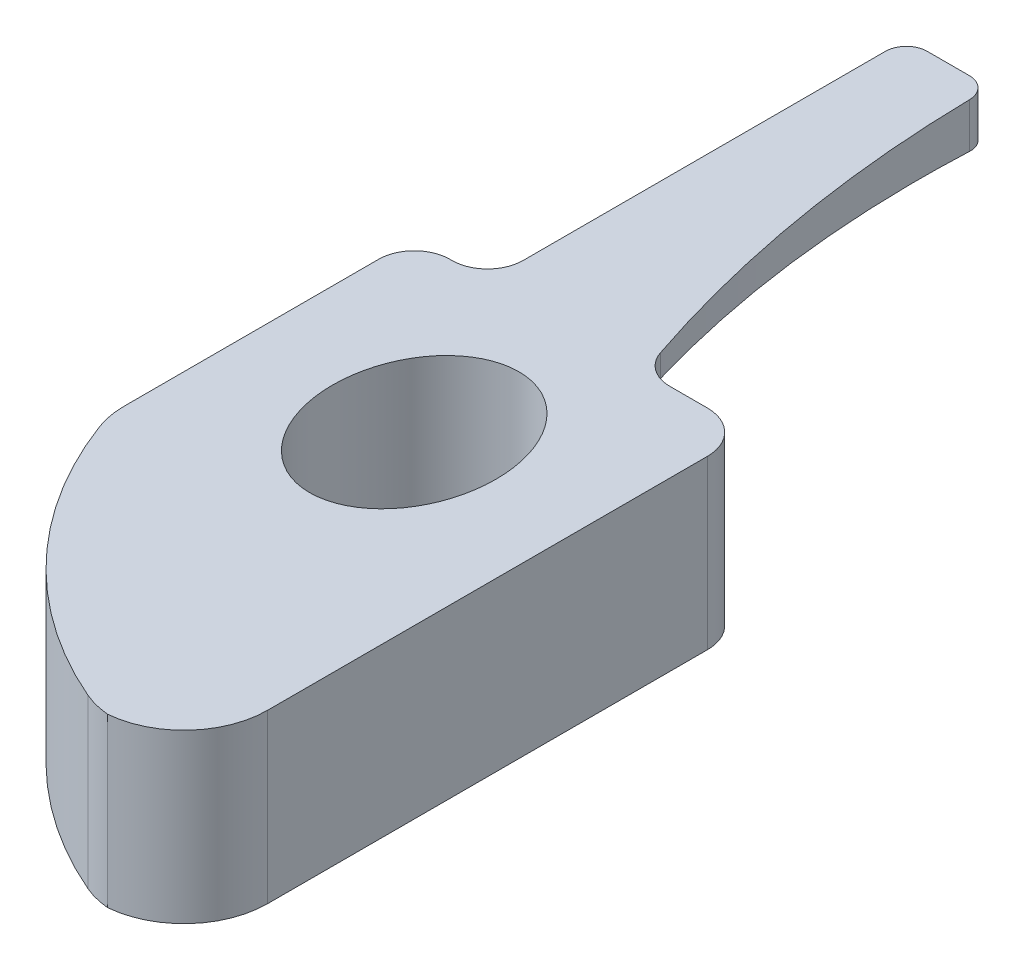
SolidWorks part; units mm, degrees
ref_plane "Front Plane" through (0, 0, 0) normal (0, 0, 1) x (1, 0, 0)
ref_plane "Top Plane" through (0, 0, 0) normal (0, 1, 0) x (1, 0, 0)
ref_plane "Right Plane" through (0, 0, 0) normal (1, 0, 0) x (0, 0, -1)
sketch "Sketch1" plane through (0, 0, 0) normal (0, 1, 0) x (1, 0, 0)
  line L0 (0, 0) -> (5.5, 0) construction
  line L5 (-4, 4) -> (4, 4)
  line L6 (-4, 4) -> (-4, -3.2725)
  line L7 (1.9535, -9.5) -> (4, -9.5)
  line L8 (4, 4) -> (4, -9.5)
  line L9 (5.5, 0) -> (5.5, -0.15) construction
  arc A0 (-4.5, -0.15) -> (4.157, -10.0594) centre (5.5, -0.15) ccw construction
  arc A1 (-4, -3.2725) -> (1.9535, -9.5) centre (5.5, -0.15) ccw
  ellipse E0 centre (0, 0) end of major axis (0, -2.5) minor radius 1.95
  point P0 (0, 0)
  dimension "D8" = 10
  dimension "D1" = 5
  dimension "D2" = 3.9
  dimension "D3" = 4
  dimension "D4" = 4
  dimension "D5" = 7
  dimension "D6" = 5.5
  dimension "D7" = 0.15
extrude "Boss-Extrude1" add sketch "Sketch1" along normal blind 4
sketch "Sketch6" plane through (-4, 0, 0) normal (-1, 0, 0) x (0, 0, 1)
  line L0 (-4, 4) -> (-14, 4)
  line L1 (-14, 4) -> (-14, 2.9)
  line L2 (-14, 2.9) -> (-4, 3.5)
  line L3 (-4, 4) -> (-4, 0) construction
  line L4 (-4, 3.5) -> (-4, 4)
  line L5 (-4, 4) -> (3.2725, 4) construction
  dimension "D1" = 1.1
  dimension "D2" = 0.5
  dimension "D3" = 10
extrude "Boss-Extrude3" add sketch "Sketch6" against normal up to surface (8 mm away)
sketch "Sketch7" plane through (0, 4, 0) normal (0, 1, 0) x (1, 0, 0)
  line L0 (-0.25, 14) -> (4, 14)
  line L1 (4, 14) -> (-4, 14) construction
  line L2 (4, 14) -> (4, 4)
  line L3 (4, 4) -> (1.5, 4)
  line L4 (-2.25, 14) -> (-2.25, 4)
  line L5 (0, 0) -> (0, 14) construction
  line L6 (-2.25, 14) -> (-4, 14)
  line L7 (-4, 14) -> (-4, 4)
  line L8 (-4, 4) -> (-2.25, 4)
  line L9 (-4, 14) -> (-4, -3.2725) construction
  arc A0 (-0.25, 14) -> (1.5, 4) centre (29.1964, 14) ccw
  point P15 (-1.7617, 14)
  point P16 (-1.7386, 4)
  dimension "D2" = 1.75
  dimension "D1" = 1.75
  dimension "D3" = 2
extrude "Cut-Extrude1" cut sketch "Sketch7" against normal through all
fillet "Fillet1" radius 0.5 3 edges at (-0.25, 3.45, -14) (-0.375, 3.5, -4) (-2.25, 3.45, -14)
fillet "Fillet4" radius 0.85 3 edges at (1.5, 3.4846, -4) (-2.25, 3.4846, -4) (-4, 2, -4)
fillet "Fillet2" radius 1 1 edges at (4, 2, -4)
fillet "Fillet3" radius 2 3 edges at (4, 2, 9.5) (-4, 2, 3.2725) (1.9535, 2, 9.5)
